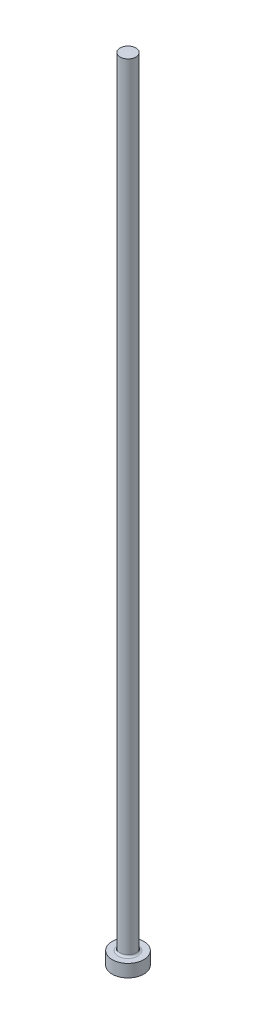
SolidWorks part; units mm, degrees
ref_plane "Plano frontal" through (0, 0, 0) normal (0, 0, 1) x (1, 0, 0)
ref_plane "Plano superior" through (0, 0, 0) normal (0, 1, 0) x (1, 0, 0)
ref_plane "Plano direito" through (0, 0, 0) normal (1, 0, 0) x (0, 0, -1)
sketch "Esboço1" plane through (0, 0, 0) normal (0, 0, 1) x (1, 0, 0)
  line L0 (0, 0) -> (2.5, 0)
  line L1 (2.5, 0) -> (2.5, 2)
  line L2 (2.5, 2) -> (1.55, 2)
  line L3 (1.25, 2.3) -> (1.25, 125)
  line L4 (1.25, 125) -> (0, 125)
  line L5 (0, 125) -> (0, 0) construction
  line L6 (0, 0) -> (0, 125)
  arc A0 (1.55, 2) -> (1.25, 2.3) centre (1.55, 2.3) cw
  dimension "D3" = 0.3
  dimension "D1" = 5
  dimension "D2" = 2.5
  dimension "D4" = 2
  dimension "D5" = 125
revolve "Revolução1" add sketch "Esboço1" angle 360 about L5
sketch "Esboço2"
  dimension "D1" = 0.2812
  dimension "D2" = 0.4375
  dimension "D3" = 0.1875
  dimension "D4" = 1.3438
wrap "Envolver1" sketch "Esboço2" wrap type deboss source sketch "Esboço2" thickness 0.1 parameters "D1"=0.1
